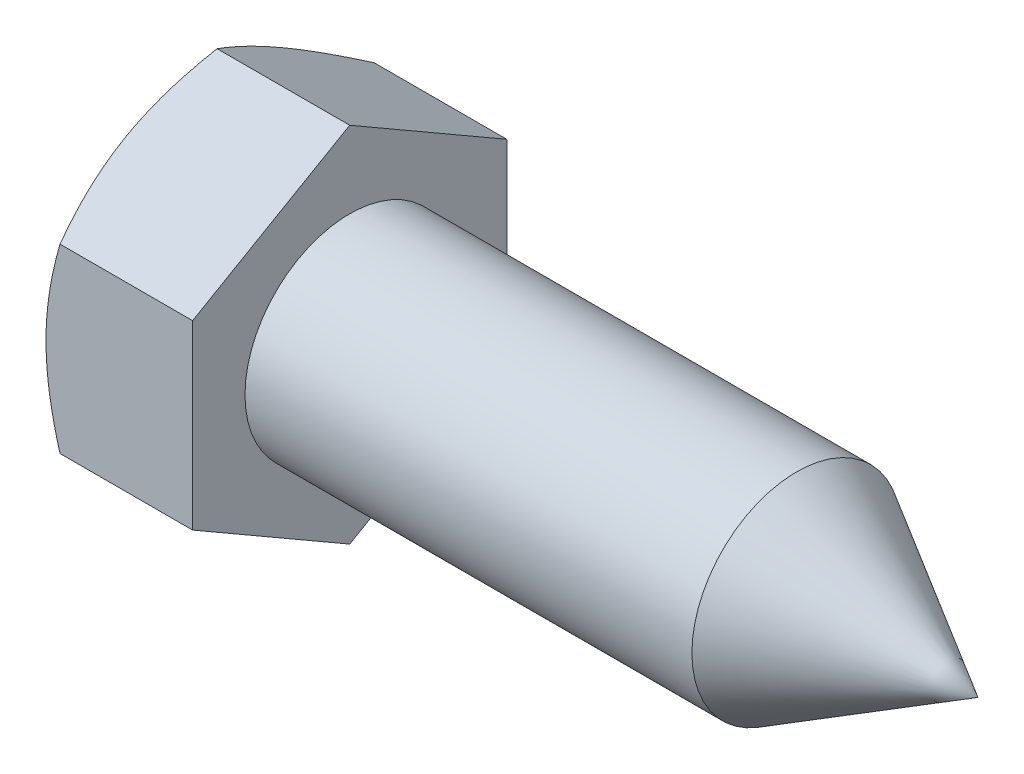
SolidWorks part; units mm, degrees
ref_plane "Plane1" through (0, 0, 0) normal (0, 0, 1) x (1, 0, 0)
ref_plane "Plane2" through (0, 0, 0) normal (0, 1, 0) x (1, 0, 0)
ref_plane "Plane3" through (0, 0, 0) normal (1, 0, 0) x (0, 0, -1)
sketch "Sketch1" plane through (0, 0, 0) normal (1, 0, 0) x (0, 0, -1)
  line L0 (19.05, 10.9985) -> (19.05, -10.9985)
  line L1 (-19.05, 10.9985) -> (-19.05, -10.9985)
  line L2 (19.05, -10.9985) -> (0, -21.997)
  line L3 (0, -21.997) -> (-19.05, -10.9985)
  line L4 (19.05, 10.9985) -> (0, 21.997)
  line L5 (0, 21.997) -> (-19.05, 10.9985)
  dimension "Width_flats" = 38.1
  dimension "D2" = 120
  dimension "D3" = 19.05
  dimension "D4" = 19.05
  dimension "D5" = 19.05
extrude "BaseHead" add sketch "Sketch1" along normal blind 17.78
sketch "Sketch2" plane through (0, 0, 0) normal (0, 0, 1) x (1, 0, 0)
  line L0 (0, 10.9985) -> (0, -10.9985) construction
  line L1 (0, 0) -> (93.98, 0)
  line L2 (0, 0) -> (0, 12.7)
  line L3 (0, 12.7) -> (71.983, 12.7)
  line L4 (93.98, 0) -> (71.983, -12.7) construction
  line L6 (93.98, 0) -> (71.983, 12.7)
  line L7 (0, 0) -> (120.65, 0) construction
  line L8 (0, -12.7) -> (71.983, -12.7) construction
  line L9 (17.78, 21.997) -> (17.78, 10.9985) construction
  dimension "Length" = 76.2
  dimension "Diameter" = 25.4
  dimension "Point_ang" = 60
revolve "BaseBody" add sketch "Sketch2" angle 360 about L7
sketch "Sketch3" plane through (0, 0, 0) normal (0, 0, 1) x (1, 0, 0)
  line L0 (0, 19.05) -> (5.3677, 28.347)
  line L1 (0, 21.997) -> (0, 10.9985) construction
  line L2 (5.3677, 28.347) -> (5.3677, 34.697)
  line L3 (5.3677, 34.697) -> (-12.7, 34.697)
  line L4 (-12.7, 34.697) -> (-12.7, 19.05)
  line L5 (-12.7, 19.05) -> (0, 19.05)
  line L6 (0, 0) -> (99.06, 0) construction
  line L7 (17.78, 21.997) -> (0, 21.997) construction
  dimension "D1" = 19.05
  dimension "D2" = 6.35
  dimension "D3" = 12.7
  dimension "D4" = 6.35
  dimension "Head_ch_ang" = 30
revolve "HeadChamfer" cut sketch "Sketch3" angle 360 about L6
fillet "HeadFillet" [suppressed] radius 2.286
equation "\"D3@Sketch1\" = \"Width_flats@Sketch1\" / 2"
equation "\"D4@Sketch1\" = \"D3@Sketch1\""
equation "\"D5@Sketch1\" = \"D4@Sketch1\""
equation "\"D1@Sketch3\" = \"Width_flats@Sketch1\" / 2"
